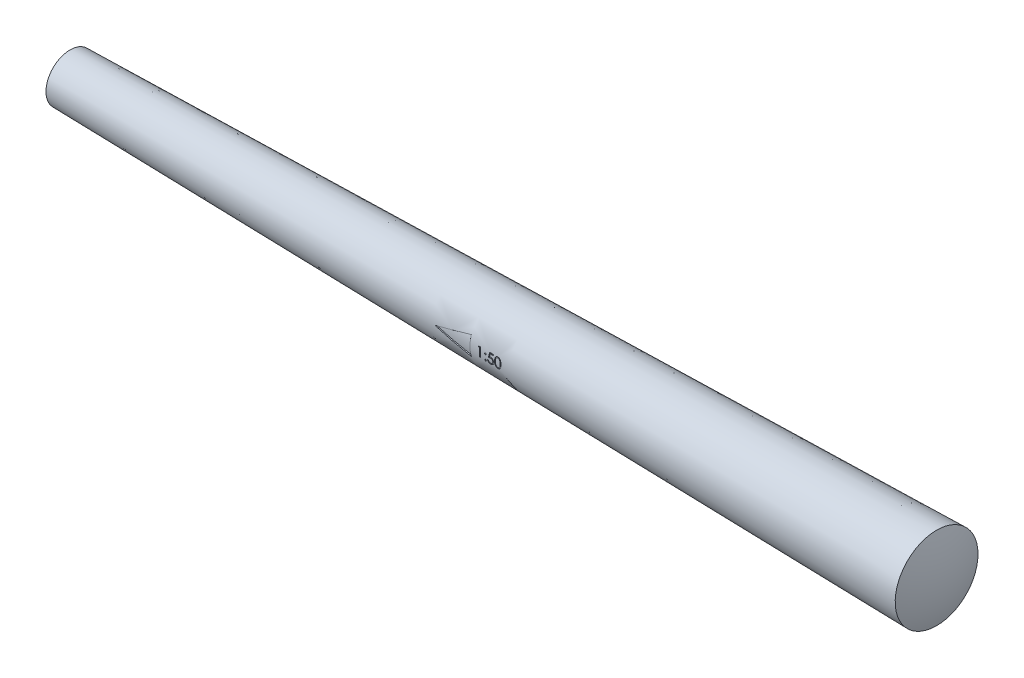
SolidWorks part; units mm, degrees
ref_plane "Front Plane" through (0, 0, 0) normal (0, 0, 1) x (1, 0, 0)
ref_plane "Top Plane" through (0, 0, 0) normal (0, 1, 0) x (1, 0, 0)
ref_plane "Right Plane" through (0, 0, 0) normal (1, 0, 0) x (0, 0, -1)
sketch "Sketch1" plane through (0, 0, 0) normal (1, 0, 0) x (0, 0, -1)
  circle A0 centre (0, 0) radius 2.5
  dimension "D1" = 5
extrude "Extrude1" add sketch "Sketch1" along normal mid plane 90
draft "Draft1" type of draft neutral plane draft angle 1.146 faces to draft 1 parameters "D1"=1.146
sketch "Sketch2" plane through (0, 0, 0) normal (0, 0, 1) x (1, 0, 0)
  line L0 (-45, 0) -> (-45, 2.5)
  line L1 (-45, 2.5) -> (-45, -2.5) construction
  line L2 (-45, 0) -> (-45.75, 0)
  line L3 (-45.75, 0) -> (-45.75, -3.4) construction
  line L4 (45, 0) -> (45, 4.3001)
  line L5 (45, -4.3001) -> (45, 4.3001) construction
  line L6 (45, 0) -> (45.75, 0)
  line L7 (45.75, 0) -> (45.75, -3.4) construction
  line L8 (-45, -2.5) -> (45, -4.3001) construction
  arc A0 (-45.75, 0) -> (-45, 2.5) centre (-41.2083, 0) cw
  arc A1 (45.75, 0) -> (45, 4.3001) centre (33.048, 0) ccw
  point P14 (0, -3.4)
revolve "Revolve1" add sketch "Sketch2" angle 360 about L2
sketch "Sketch5" plane through (0, 0, 0) normal (0, 0, 1) x (1, 0, 0)
  line L0 (0, 3.4) -> (0, -3.4) construction
  line L1 (45, 4.3001) -> (-45, 2.5) construction
  line L2 (-45, -2.5) -> (45, -4.3001) construction
ref_plane "Plane2" through (0, 0, 0) normal (-0.02, 0, 0.9998) x (0.9998, 0, 0.02)
sketch "Sketch6" plane through (0, 0, 0) normal (-0.02, 0, 0.9998) x (0.9998, 0, 0.02)
  line L0 (0, 0) -> (0, 1)
  line L1 (0, 3.4) -> (0, -3.4) construction
  line L2 (0, 1) -> (-3.7321, 0)
  line L3 (-3.7321, 0) -> (0, -1)
  line L4 (0, -1) -> (0, 0)
  line L5 (0, -0.5) -> (4, -0.5) construction
  text T0 "1:50" font "Century Gothic" height 1
  dimension "D1" = 2
  dimension "D2" = 30
  dimension "D3" = 4
wrap "Wrap2" sketch "Sketch6" wrap type deboss source sketch "Sketch6" thickness 0.1 parameters "D1"=0.1
equation "\"D2@Sketch2\" = \"D1@Sketch2\""
